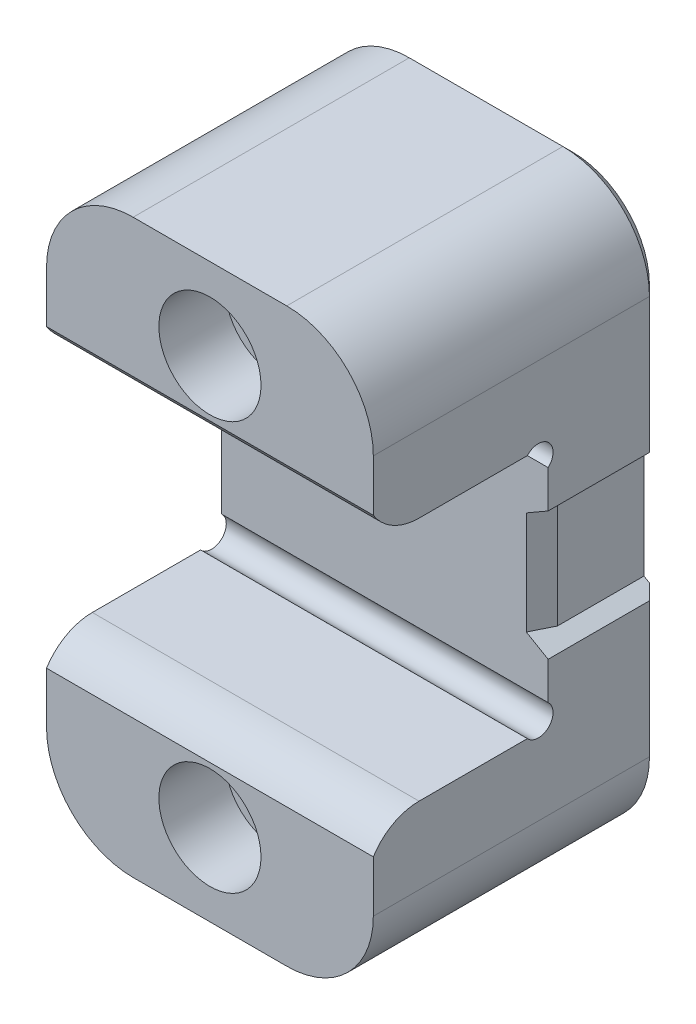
SolidWorks part; units mm, degrees
ref_plane "Front Plane" through (0, 0, 0) normal (0, 0, 1) x (1, 0, 0)
ref_plane "Top Plane" through (0, 0, 0) normal (0, 1, 0) x (1, 0, 0)
ref_plane "Right Plane" through (0, 0, 0) normal (1, 0, 0) x (0, 0, -1)
sketch "Sketch1" plane through (0, 0, 0) normal (1, 0, 0) x (0, 0, -1)
  line L0 (0, 0) -> (50000, 0) construction
  line L1 (0, 19.05) -> (27.178, 19.05)
  line L2 (0, 44.45) -> (44.45, 44.45)
  line L3 (0, 44.45) -> (0, 19.05)
  line L4 (0, -44.45) -> (44.45, -44.45)
  line L5 (44.45, 44.45) -> (44.45, -44.45)
  line L6 (27.178, 19.05) -> (27.178, -19.05)
  line L7 (27.178, -19.05) -> (0, -19.05)
  line L9 (0, 27.94) -> (0, -27.94) construction
  line L10 (0, -19.05) -> (0, -44.45)
  dimension "D1" = 44.45
  dimension "D2" = 88.9
  dimension "D3" = 27.178
  dimension "D4" = 38.1
extrude "Extrude1" add sketch "Sketch1" along normal mid plane 50.8
fillet "Fillet1" radius 13.462 4 edges at (-25.4, -44.45, -22.225) (-25.4, 44.45, -22.225) (25.4, -44.45, -22.225) (25.4, 44.45, -22.225)
sketch "Sketch2" plane through (-19.05, 0, -44.45) normal (0, 0, 1) x (1, 0, 0)
  line L0 (0, 0) -> (50000, 0) construction
  line L1 (44.45, -30.988) -> (44.45, 30.988) construction
  line L2 (42.0687, 8.6085) -> (45.2437, 10.4415)
  line L3 (42.0687, 8.6085) -> (42.0687, -8.6085)
  line L4 (42.0687, -8.6085) -> (45.2437, -10.4415)
  line L5 (45.2437, 10.4415) -> (45.2437, -10.4415)
  point P4 (43.6562, 9.525)
  point P10 (43.6562, -9.525)
  dimension "D1" = 19.05
  dimension "D2" = 2.3813
  dimension "D3" = 30
  dimension "D4" = 3.175
extrude "Cut-Extrude1" cut sketch "Sketch2" along normal through all
sketch "Sketch5" plane through (25.4, 0, 0) normal (1, 0, 0) x (0, 0, -1)
  line L0 (0, 0) -> (50000, 0) construction
  line L2 (0, 30.988) -> (0, 19.05) construction
  line L3 (0, -19.05) -> (0, -30.988) construction
  line L4 (-5.588, -13.4703) -> (7.112, -13.4703)
  line L5 (-5.588, -13.4703) -> (-5.588, -22.9953)
  line L6 (-5.588, -22.9953) -> (0, -22.9953)
  line L7 (7.112, -13.4703) -> (7.112, -19.05)
  line L8 (27.178, -19.05) -> (0, -19.05) construction
  line L9 (7.112, 13.4703) -> (7.112, 19.05)
  line L10 (-5.588, 22.9953) -> (0, 22.9953)
  line L11 (-5.588, 13.4703) -> (-5.588, 22.9953)
  line L12 (-5.588, 13.4703) -> (7.112, 13.4703)
  arc A0 (1.7646, -20.2306) -> (7.112, -19.05) centre (7.112, -31.75) cw construction
  arc A1 (0, -22.9953) -> (1.7646, -20.2306) centre (3.048, -22.9953) cw construction
  arc A2 (0, 22.9953) -> (1.7646, 20.2306) centre (3.048, 22.9953) ccw construction
  arc A3 (1.7646, 20.2306) -> (7.112, 19.05) centre (7.112, 31.75) ccw construction
  arc A4 (0, -22.9953) -> (7.112, -19.05) centre (7.112, -27.4329) cw
  arc A5 (0, 22.9953) -> (7.112, 19.05) centre (7.112, 27.4329) ccw
  dimension "D1" = 3.048
  dimension "D2" = 12.7
  dimension "D3" = 9.525
  dimension "D4" = 12.7
  dimension "D5" = 7.112
extrude "Cut-Extrude2" cut sketch "Sketch5" against normal through all
sketch "Sketch6" plane through (25.4, 0, 0) normal (1, 0, 0) x (0, 0, -1)
  line L0 (0, 0) -> (50000, 0) construction
  line L3 (27.178, 19.05) -> (27.178, 9.9833) construction
  line L4 (7.112, 19.05) -> (27.178, 19.05) construction
  circle A0 centre (25.654, 17.526) radius 2.286
  circle A1 centre (25.654, -17.526) radius 2.286
  dimension "D2" = 0.762
  dimension "D3" = 2.286
  dimension "D1" = 0.762
extrude "Cut-Extrude3" cut sketch "Sketch6" against normal through all
hole_wizard "3/8\"-16 CBORE" positions "Sketch4" profile "Sketch3" counterbore size "3/8" standard "Ansi Inch"
sketch "Sketch4" plane through (0, 0, 0) normal (0, 0, 1) x (1, 0, 0)
  line L0 (0, 0) -> (0, 50000) construction
  line L1 (0, 0) -> (50000, 0) construction
  point P0 (0, 31.75)
  point P12 (0, -31.75)
  dimension "D1" = 63.5
sketch "Sketch3" plane through (0, 31.75, 0) normal (1, 0, 0) x (0, -1, 0)
  line L0 (0, 0) -> (0, 44.45)
  line L1 (0, 44.45) -> (4.7625, 44.45)
  line L3 (4.7625, 44.45) -> (4.7625, 10.32)
  line L4 (4.7625, 10.32) -> (7.9375, 10.32)
  line L5 (7.9375, 10.32) -> (7.9375, 0)
  line L7 (7.9375, 0) -> (0, 0)
  line L11 (0, -6.35) -> (0, 107.95) construction
  dimension "Thru Hole Dia." = 9.525
  dimension "Thru Hole Depth" = 44.45
  dimension "C'Bore Dia." = 15.875
  dimension "C'Bore Depth" = 10.32
hole_wizard "1/2-13 Tapped Hole1" positions "Sketch8" profile "Sketch7" tap size "1/2-13" standard "Ansi Inch"
sketch "Sketch8" plane through (0, 0, -10.32) normal (0, 0, 1) x (1, 0, 0)
  point P0 (0, 31.75)
  point P1 (0, -31.75)
sketch "Sketch7" plane through (0, 31.75, -10.32) normal (1, 0, 0) x (0, -1, 0)
  line L0 (0, 0) -> (0, 34.13)
  line L1 (0, 34.13) -> (5.3581, 34.13)
  line L2 (5.3581, 34.13) -> (5.3581, 0)
  line L5 (5.3581, 0) -> (0, 0)
  line L11 (0, -6.35) -> (0, 107.95) construction
  dimension "Thread Major Dia." = 10.7163
  dimension "Thru Tap Drill Depth" = 34.13
chamfer "Chamfer3" distance 3.81 angle 15 1 edges at (23.0187, 0, -27.178)
chamfer "Chamfer1" distance 1.524 angle 45 9 edges at (-25.4, 0, -44.45) (-21.4571, -40.5071, -44.45) (0, -44.45, -44.45) (0, 44.45, -44.45) (-21.4571, 40.5071, -44.45) (25.4, -20.4856, -44.45) (21.4571, -40.5071, -44.45) (25.4, 20.4856, -44.45) (21.4571, 40.5071, -44.45)
